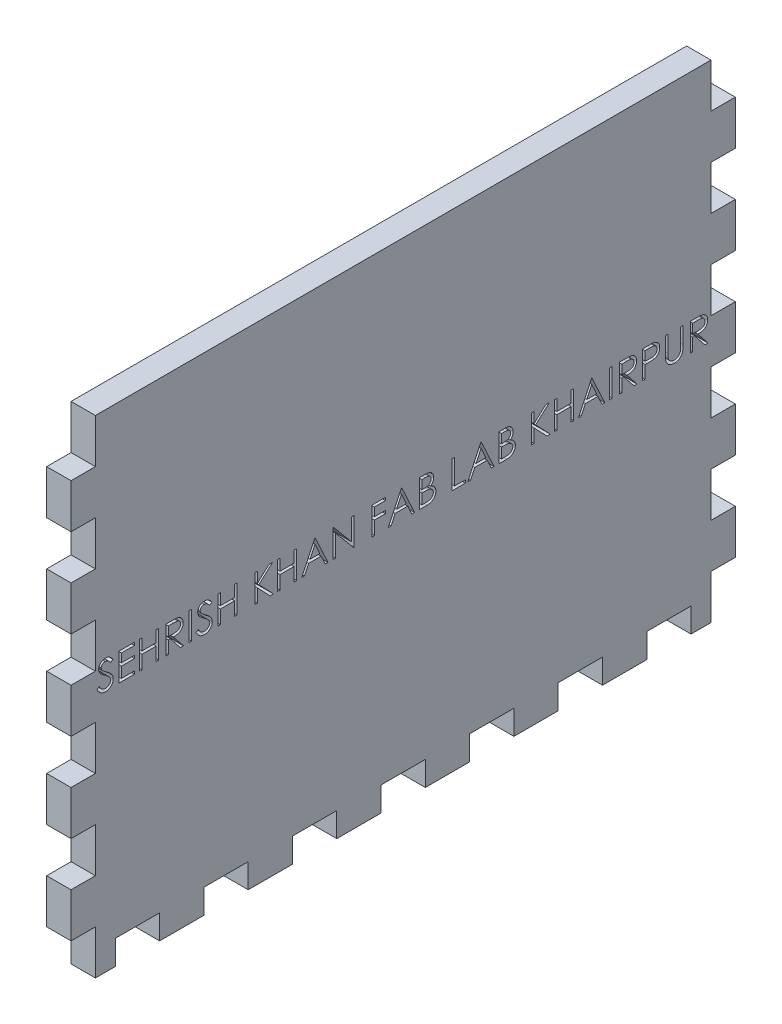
SolidWorks part; units mm, degrees
ref_plane "Front Plane" through (0, 0, 0) normal (0, 0, 1) x (1, 0, 0)
ref_plane "Top Plane" through (0, 0, 0) normal (0, 1, 0) x (1, 0, 0)
ref_plane "Right Plane" through (0, 0, 0) normal (1, 0, 0) x (0, 0, -1)
sketch "Sketch2" plane through (0, 0, 0) normal (1, 0, 0) x (0, 0, -1)
  line L0 (-33.02, -27.94) -> (-33.02, -25.146)
  line L1 (-38.1, 27.94) -> (38.1, 27.94)
  line L2 (-38.1, 27.94) -> (-38.1, -27.94)
  line L3 (-38.1, -27.94) -> (-33.02, -27.94)
  line L4 (38.1, 27.94) -> (38.1, -27.94)
  line L5 (-38.1, 27.94) -> (38.1, -27.94) construction
  line L6 (-38.1, -27.94) -> (38.1, 27.94) construction
  line L7 (-33.02, -25.146) -> (-27.94, -25.146)
  line L8 (-27.94, -25.146) -> (-27.94, -27.94)
  line L9 (-22.86, -27.94) -> (-22.86, -25.146)
  line L10 (-27.94, -27.94) -> (-22.86, -27.94)
  line L11 (-22.86, -25.146) -> (-17.78, -25.146)
  line L12 (-17.78, -25.146) -> (-17.78, -27.94)
  line L13 (-12.7, -27.94) -> (-12.7, -25.146)
  line L14 (-17.78, -27.94) -> (-12.7, -27.94)
  line L15 (-12.7, -25.146) -> (-7.62, -25.146)
  line L16 (-7.62, -25.146) -> (-7.62, -27.94)
  line L17 (-2.54, -27.94) -> (-2.54, -25.146)
  line L18 (-7.62, -27.94) -> (-2.54, -27.94)
  line L19 (-2.54, -25.146) -> (2.54, -25.146)
  line L20 (2.54, -25.146) -> (2.54, -27.94)
  line L21 (7.62, -27.94) -> (7.62, -25.146)
  line L22 (2.54, -27.94) -> (7.62, -27.94)
  line L23 (7.62, -25.146) -> (12.7, -25.146)
  line L24 (12.7, -25.146) -> (12.7, -27.94)
  line L25 (17.78, -27.94) -> (17.78, -25.146)
  line L26 (12.7, -27.94) -> (17.78, -27.94)
  line L27 (17.78, -25.146) -> (22.86, -25.146)
  line L28 (22.86, -25.146) -> (22.86, -27.94)
  line L29 (27.94, -27.94) -> (27.94, -25.146)
  line L30 (22.86, -27.94) -> (27.94, -27.94)
  line L31 (27.94, -25.146) -> (33.02, -25.146)
  line L32 (33.02, -25.146) -> (33.02, -27.94)
  line L33 (33.02, -27.94) -> (38.1, -27.94)
  point P0 (0, 0)
  dimension "D1" = 55.88
  dimension "D2" = 76.2
  dimension "D3" = 2.794
  dimension "D4" = 5.08
extrude "Boss-Extrude1" add sketch "Sketch2" along normal blind 2.794
other "Cavity1"
other "backpart<1>@MyBox1"
other "Part1box<3>@MyBox1"
sketch "Sketch3" plane through (2.794, 0, 0) normal (1, 0, 0) x (0, 0, -1)
  line L0 (-38.1, 0) -> (38.1, 0) construction
  line L1 (-38.1, 2.54) -> (-38.1, -2.54) construction
  line L2 (38.1, -2.54) -> (38.1, 2.54) construction
  line L3 (-6.2006, 0) -> (-6.2006, 27.94) construction
  line L4 (35.306, 27.94) -> (-35.306, 27.94) construction
  text T0 "SEHRISH KHAN FAB LAB KHAIRPUR"
extrude "Cut-Extrude2" cut sketch "Sketch3" against normal through all
